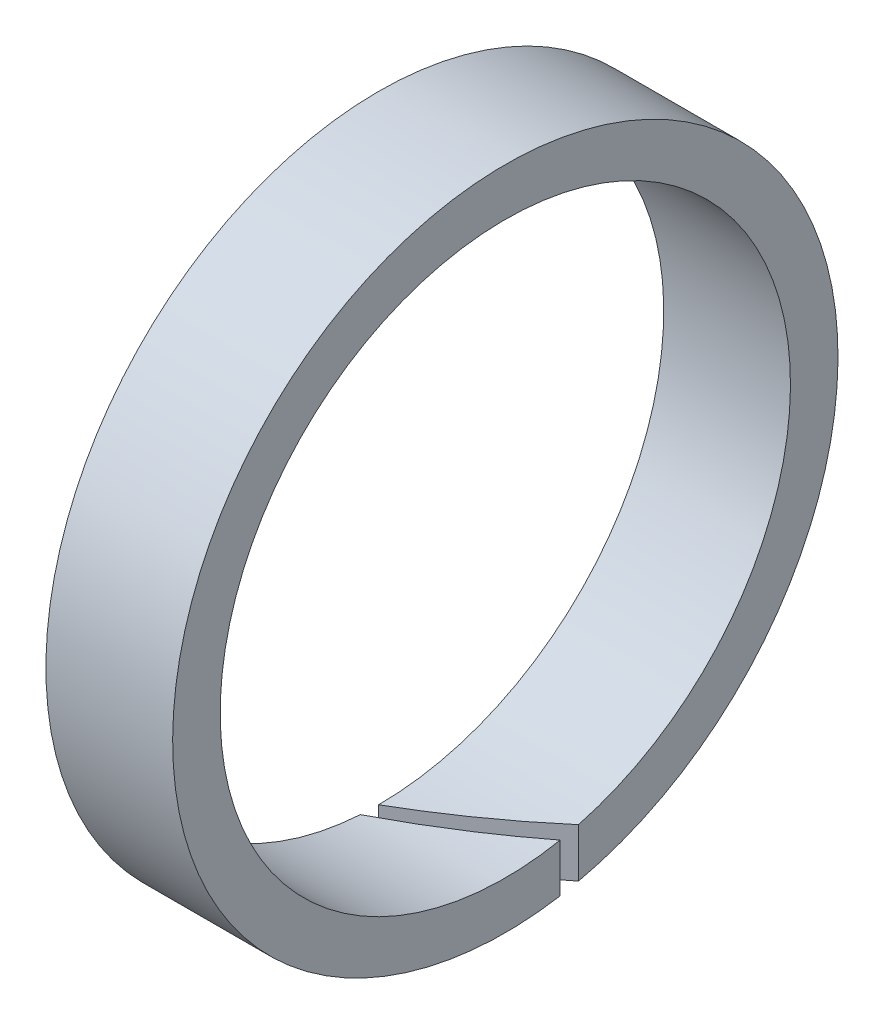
SolidWorks part; units mm, degrees
ref_plane "Face" through (0, 0, 0) normal (0, 0, 1) x (1, 0, 0)
ref_plane "Dessus" through (0, 0, 0) normal (0, 1, 0) x (1, 0, 0)
ref_plane "Droite" through (0, 0, 0) normal (1, 0, 0) x (0, 0, -1)
sketch "Esquisse1" plane through (0, 0, 0) normal (0, 0, 1) x (1, 0, 0)
  line L0 (0, 9) -> (4, 9)
  line L1 (4, 9) -> (4, 10.5)
  line L2 (4, 10.5) -> (0, 10.5)
  line L3 (0, 10.5) -> (0, 9)
  line L4 (0, 0) -> (10.827, 0) construction
  dimension "D1" = 1.5
  dimension "D2" = 4
  dimension "D3" = 9
revolve "Révolution1" add sketch "Esquisse1" angle 360 about L4
sketch "Esquisse2" plane through (0, 0, 0) normal (0, 1, 0) x (1, 0, 0)
  line L0 (0, 0) -> (4, 2.3094)
  line L1 (4, -10.5) -> (4, 10.5) construction
  line L2 (4, 2.3094) -> (4, 1.7321)
  line L3 (4, 1.7321) -> (0, -0.5774)
  line L4 (0, 10.5) -> (0, -10.5) construction
  line L5 (0, -0.5774) -> (0, 0)
  line L6 (0, 0) -> (13.8216, 0) construction
  dimension "D1" = 0.5
  dimension "D2" = 30
extrude "Enlèv. mat.-Extru.1" cut sketch "Esquisse2" against normal through all
